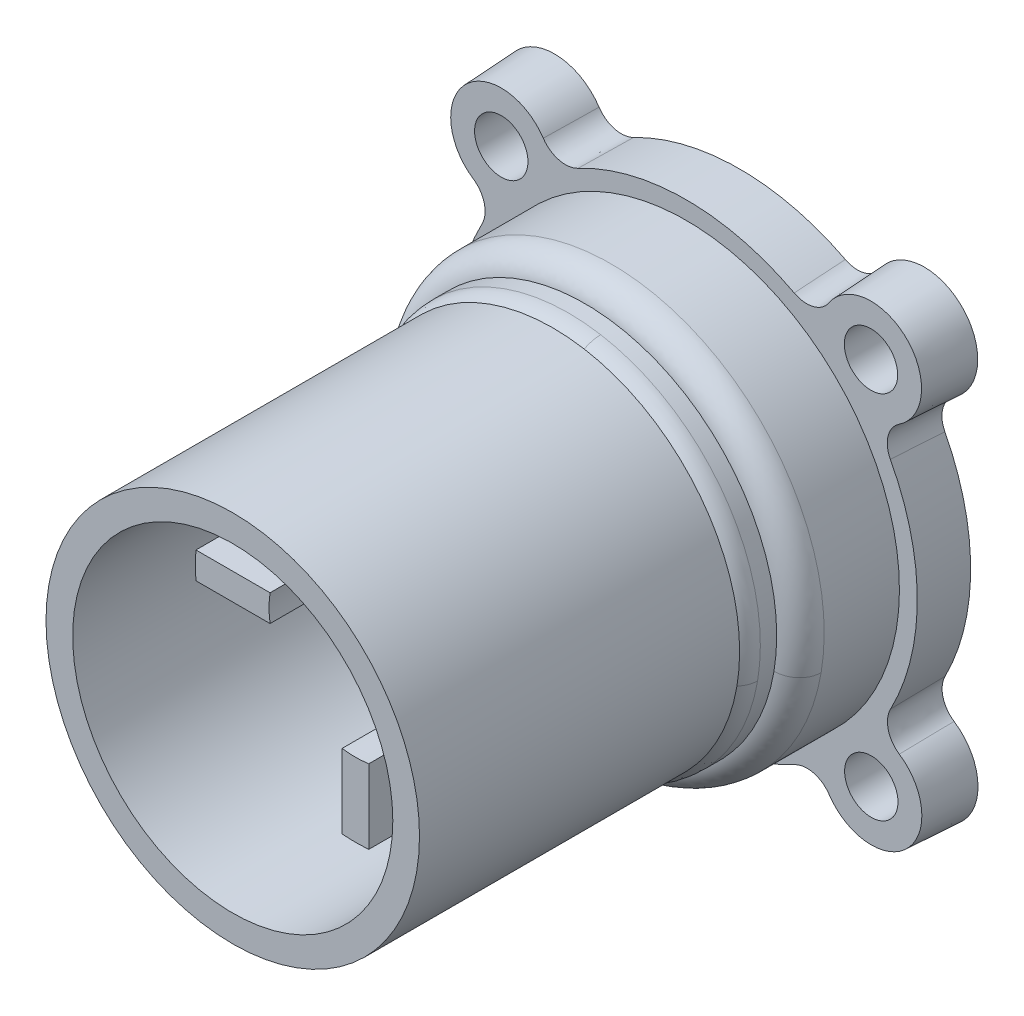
SolidWorks part; units mm, degrees
ref_plane "Plan de face" through (0, 0, 0) normal (0, 0, 1) x (1, 0, 0)
ref_plane "Plan de dessus" through (0, 0, 0) normal (0, 1, 0) x (1, 0, 0)
ref_plane "Plan de droite" through (0, 0, 0) normal (1, 0, 0) x (0, 0, -1)
imported_body "Importée3"
sketch "Esquisse1" plane through (0, 0, 7.5) normal (0, 0, 1) x (1, 0, 0)
  circle A0 centre (0, 0) radius 3.5
extrude "Boss.-Extru.1" add sketch "Esquisse1" along normal blind 6
sketch "Esquisse2" plane through (0, 0, 6.4101) normal (0, 0, -1) x (-1, 0, 0)
  circle A0 centre (0, 0) radius 3.995
extrude "Boss.-Extru.2" add sketch "Esquisse2" along normal blind 1.4101
ref_plane "Plan4" through (0, 0, 5) normal (0, 0, 1) x (1, 0, 0)
sketch "Esquisse3" plane through (0, 0, 5) normal (0, 0, 1) x (1, 0, 0)
  arc A0 (-2.4719, 3.5551) -> (-3.559, 2.4663) centre (-3.4676, 3.4621) ccw
  arc A1 (-3.559, 2.4663) -> (-2.4719, 3.5551) centre (0, 0) ccw
extrude "Boss.-Extru.3" add sketch "Esquisse3" against normal blind 1
hole_wizard "Diamètre du perçage Ø6.0 (6)1" positions "Esquisse5" profile "Esquisse4" hole size "Ø6.0" standard "Ansi Métrique"
sketch "Esquisse5" plane through (0, 0, 13.5) normal (0, 0, 1) x (1, 0, 0)
  point P0 (0, 0)
sketch "Esquisse4" plane through (0, 0, 13.5) normal (1, 0, 0) x (0, -1, 0)
  line L0 (0, 0) -> (0, 6)
  line L1 (0, 6) -> (3, 6)
  line L2 (3, 6) -> (3, 0)
  line L5 (3, 0) -> (0, 0)
  line L10 (0, 6) -> (-3, 6) construction
  line L11 (0, -6.35) -> (0, 107.95) construction
  dimension "Diamètre du perçage" = 6
  dimension "Profondeur du perçage" = 6
  dimension "Angle de pointe" = 180
sketch "Esquisse6" plane through (0, 0, 7.5) normal (0, 0, 1) x (1, 0, 0)
  line L0 (2.9896, -0.25) -> (0.25, -0.25)
  line L1 (0.25, -0.25) -> (0.25, -2.9896)
  arc A0 (0.25, -2.9896) -> (2.9896, -0.25) centre (0, 0) cw
extrude "Boss.-Extru.4" add sketch "Esquisse6" along normal blind 3.7
sketch "Esquisse7" plane through (0, 0, 11.2) normal (0, 0, 1) x (1, 0, 0)
  line L0 (-0.25, -0.25) -> (-2.9896, -0.25)
  line L1 (-0.25, -2.9896) -> (-0.25, -0.25)
  arc A0 (-2.9896, -0.25) -> (-0.25, -2.9896) centre (0, 0) ccw
extrude "Enlèv. mat.-Extru.1" cut sketch "Esquisse7" against normal blind 3.7
sketch "Esquisse8" plane through (0, 0, 11.2) normal (0, 0, 1) x (1, 0, 0)
  line L0 (0.25, 2.9896) -> (0.25, 0.25)
  line L1 (0.25, 0.25) -> (2.9896, 0.25)
  arc A0 (2.9896, 0.25) -> (0.25, 2.9896) centre (0, 0) ccw
extrude "Enlèv. mat.-Extru.2" cut sketch "Esquisse8" against normal blind 3.7
sketch "Esquisse9" plane through (0, 0, 11.2) normal (0, 0, 1) x (1, 0, 0)
  line L0 (-2.9896, 0.25) -> (-0.25, 0.25)
  line L1 (-0.25, 0.25) -> (-0.25, 2.9896)
  arc A0 (-0.25, 2.9896) -> (-2.9896, 0.25) centre (0, 0) ccw
extrude "Enlèv. mat.-Extru.3" cut sketch "Esquisse9" against normal blind 3.7
hole_wizard "Perçage1" positions "Esquisse11" profile "Esquisse10" legacy
sketch "Esquisse11" plane through (0, 0, 4) normal (0, 0, -1) x (-1, 0, 0)
  point P0 (0, 0)
sketch "Esquisse10" plane through (0, 0, 4) normal (1, 0, 0) x (0, 1, 0)
  line L0 (0, 0) -> (0, 3)
  line L1 (0, 3) -> (3.095, 3)
  line L2 (3.095, 3) -> (3.095, 2.4)
  line L3 (3.095, 2.4) -> (3.495, 2.4)
  line L4 (3.495, 2.4) -> (3.495, 0)
  line L5 (3.495, 0) -> (0, 0)
  line L6 (0, 110) -> (0, -10) construction
  dimension "Diamètre" = 6.19
  dimension "Profondeur" = 3
  dimension "Diamètre chambrage" = 6.99
  dimension "Profondeur chambrage" = 2.4
sketch "Esquisse12" plane through (0, 0, 6.4) normal (0, 0, -1) x (-1, 0, 0)
  arc A0 (-0.7265, 3.4187) -> (-0.2661, 3.4849) centre (0, 0) cw
  arc A1 (-0.3886, 3.1562) -> (-0.5163, 3.1378) centre (0, 0) ccw
  spline S0 degree 3 poles (-0.5163, 3.1378) (-0.5311, 3.1644) (-0.5471, 3.1904) (-0.564, 3.2158) (-0.5809, 3.2411) (-0.5987, 3.2659) (-0.6172, 3.2901) (-0.6514, 3.3348) (-0.688, 3.3776) (-0.7265, 3.4187) knots 0 0 0 0 0.000091 0.000091 0.000091 0.000183 0.000183 0.000183 0.000352 0.000352 0.000352 0.000352
  spline S1 degree 3 poles (-0.3886, 3.1562) (-0.3819, 3.1859) (-0.3739, 3.2153) (-0.3648, 3.2444) (-0.3557, 3.2735) (-0.3456, 3.3023) (-0.3347, 3.3307) (-0.3145, 3.3832) (-0.2914, 3.4346) (-0.2661, 3.4849) knots 0 0 0 0 0.000091 0.000091 0.000091 0.000183 0.000183 0.000183 0.000352 0.000352 0.000352 0.000352
extrude "Boss.-Extru.5" add sketch "Esquisse12" along normal blind 1.4
sketch "Esquisse13" plane through (0, 0, 6.4) normal (0, 0, -1) x (-1, 0, 0)
  arc A0 (-1.2056, 3.2805) -> (-0.7593, 3.4115) centre (0, 0) cw
  arc A1 (-0.8338, 3.0687) -> (-0.9576, 3.0324) centre (0, 0) ccw
  spline S0 degree 3 poles (-0.9576, 3.0324) (-0.9761, 3.0566) (-0.9956, 3.0801) (-1.0159, 3.1027) (-1.0363, 3.1254) (-1.0574, 3.1474) (-1.0791, 3.1687) (-1.1193, 3.2081) (-1.1617, 3.2453) (-1.2056, 3.2805) knots 0 0 0 0 0.000091 0.000091 0.000091 0.000183 0.000183 0.000183 0.000352 0.000352 0.000352 0.000352
  spline S1 degree 3 poles (-0.7593, 3.4115) (-0.7691, 3.3826) (-0.7781, 3.3535) (-0.7862, 3.3242) (-0.7944, 3.2949) (-0.8018, 3.2653) (-0.8083, 3.2356) (-0.8203, 3.1806) (-0.8294, 3.1248) (-0.8338, 3.0687) knots 0 0 0 0 0.000091 0.000091 0.000091 0.000183 0.000183 0.000183 0.000352 0.000352 0.000352 0.000352
extrude "Boss.-Extru.6" add sketch "Esquisse13" along normal blind 1.4
sketch "Esquisse14" plane through (0, 0, 6.4) normal (0, 0, -1) x (-1, 0, 0)
  arc A0 (-1.6602, 3.0755) -> (-1.2371, 3.2687) centre (0, 0) cw
  arc A1 (-1.2621, 2.9188) -> (-1.3794, 2.8652) centre (0, 0) ccw
  spline S0 degree 3 poles (-1.3794, 2.8652) (-1.4011, 2.8866) (-1.4238, 2.907) (-1.4472, 2.9266) (-1.4705, 2.9461) (-1.4946, 2.9649) (-1.5191, 2.9829) (-1.5645, 3.0162) (-1.6117, 3.047) (-1.6602, 3.0755) knots 0 0 0 0 0.000091 0.000091 0.000091 0.000183 0.000183 0.000183 0.000352 0.000352 0.000352 0.000352
  spline S1 degree 3 poles (-1.2371, 3.2687) (-1.2426, 3.2388) (-1.2474, 3.2087) (-1.2513, 3.1785) (-1.2553, 3.1483) (-1.2584, 3.118) (-1.2606, 3.0876) (-1.2646, 3.0315) (-1.2656, 2.975) (-1.2621, 2.9188) knots 0 0 0 0 0.000091 0.000091 0.000091 0.000183 0.000183 0.000183 0.000352 0.000352 0.000352 0.000352
extrude "Boss.-Extru.7" add sketch "Esquisse14" along normal blind 1.4
sketch "Esquisse15" plane through (0, 0, 6.4) normal (0, 0, -1) x (-1, 0, 0)
  arc A0 (-2.081, 2.8079) -> (-1.6897, 3.0594) centre (0, 0) cw
  arc A1 (-1.6646, 2.7095) -> (-1.7731, 2.6398) centre (0, 0) ccw
  spline S0 degree 3 poles (-1.7731, 2.6398) (-1.7977, 2.6578) (-1.823, 2.6748) (-1.8489, 2.6908) (-1.8748, 2.7069) (-1.9013, 2.722) (-1.9282, 2.7363) (-1.9778, 2.7628) (-2.0289, 2.7866) (-2.081, 2.8079) knots 0 0 0 0 0.000091 0.000091 0.000091 0.000183 0.000183 0.000183 0.000352 0.000352 0.000352 0.000352
  spline S1 degree 3 poles (-1.6897, 3.0594) (-1.6909, 3.029) (-1.6913, 2.9985) (-1.6909, 2.968) (-1.6905, 2.9376) (-1.6893, 2.9071) (-1.6872, 2.8768) (-1.6832, 2.8206) (-1.6761, 2.7646) (-1.6646, 2.7095) knots 0 0 0 0 0.000091 0.000091 0.000091 0.000183 0.000183 0.000183 0.000352 0.000352 0.000352 0.000352
extrude "Boss.-Extru.8" add sketch "Esquisse15" along normal blind 1.4
sketch "Esquisse16" plane through (0, 0, 6.4) normal (0, 0, -1) x (-1, 0, 0)
  arc A0 (-2.4594, 2.4832) -> (-2.1079, 2.7878) centre (0, 0) cw
  arc A1 (-2.0333, 2.445) -> (-2.1308, 2.3605) centre (0, 0) ccw
  spline S0 degree 3 poles (-2.1308, 2.3605) (-2.1576, 2.3749) (-2.1851, 2.3881) (-2.2131, 2.4003) (-2.241, 2.4125) (-2.2693, 2.4237) (-2.298, 2.4341) (-2.3509, 2.4532) (-2.4049, 2.4695) (-2.4594, 2.4832) knots 0 0 0 0 0.000091 0.000091 0.000091 0.000183 0.000183 0.000183 0.000352 0.000352 0.000352 0.000352
  spline S1 degree 3 poles (-2.1079, 2.7878) (-2.1048, 2.7575) (-2.1009, 2.7273) (-2.0961, 2.6972) (-2.0914, 2.6671) (-2.0858, 2.6371) (-2.0794, 2.6074) (-2.0675, 2.5524) (-2.0525, 2.4979) (-2.0333, 2.445) knots 0 0 0 0 0.000091 0.000091 0.000091 0.000183 0.000183 0.000183 0.000352 0.000352 0.000352 0.000352
extrude "Boss.-Extru.9" add sketch "Esquisse16" along normal blind 1.4
sketch "Esquisse17" plane through (0, 0, 6.4) normal (0, 0, -1) x (-1, 0, 0)
  arc A0 (-2.7878, 2.1079) -> (-2.4832, 2.4594) centre (0, 0) cw
  arc A1 (-2.3605, 2.1308) -> (-2.445, 2.0333) centre (0, 0) ccw
  spline S0 degree 3 poles (-2.445, 2.0333) (-2.4737, 2.0437) (-2.5028, 2.0528) (-2.5321, 2.0609) (-2.5615, 2.069) (-2.5912, 2.0761) (-2.621, 2.0823) (-2.6761, 2.0937) (-2.7318, 2.1021) (-2.7878, 2.1079) knots 0 0 0 0 0.000091 0.000091 0.000091 0.000183 0.000183 0.000183 0.000352 0.000352 0.000352 0.000352
  spline S1 degree 3 poles (-2.4832, 2.4594) (-2.4758, 2.4299) (-2.4676, 2.4005) (-2.4586, 2.3714) (-2.4497, 2.3423) (-2.4399, 2.3134) (-2.4293, 2.2849) (-2.4097, 2.2322) (-2.3871, 2.1804) (-2.3605, 2.1308) knots 0 0 0 0 0.000091 0.000091 0.000091 0.000183 0.000183 0.000183 0.000352 0.000352 0.000352 0.000352
extrude "Boss.-Extru.10" add sketch "Esquisse17" along normal blind 1.4
sketch "Esquisse18" plane through (0, 0, 6.4) normal (0, 0, -1) x (-1, 0, 0)
  arc A0 (-3.0594, 1.6897) -> (-2.8079, 2.081) centre (0, 0) cw
  arc A1 (-2.6398, 1.7731) -> (-2.7095, 1.6646) centre (0, 0) ccw
  spline S0 degree 3 poles (-2.7095, 1.6646) (-2.7393, 1.6709) (-2.7694, 1.6758) (-2.7997, 1.6796) (-2.8299, 1.6834) (-2.8602, 1.6862) (-2.8906, 1.6881) (-2.9468, 1.6915) (-3.0032, 1.6919) (-3.0594, 1.6897) knots 0 0 0 0 0.000091 0.000091 0.000091 0.000183 0.000183 0.000183 0.000352 0.000352 0.000352 0.000352
  spline S1 degree 3 poles (-2.8079, 2.081) (-2.7964, 2.0528) (-2.7841, 2.0249) (-2.7711, 1.9974) (-2.7581, 1.9698) (-2.7443, 1.9427) (-2.7297, 1.9159) (-2.7028, 1.8665) (-2.6731, 1.8185) (-2.6398, 1.7731) knots 0 0 0 0 0.000091 0.000091 0.000091 0.000183 0.000183 0.000183 0.000352 0.000352 0.000352 0.000352
extrude "Boss.-Extru.11" add sketch "Esquisse18" along normal blind 1.4
sketch "Esquisse19" plane through (0, 0, 6.4) normal (0, 0, -1) x (-1, 0, 0)
  arc A0 (-3.2687, 1.2371) -> (-3.0755, 1.6602) centre (0, 0) cw
  arc A1 (-2.8652, 1.3794) -> (-2.9188, 1.2621) centre (0, 0) ccw
  spline S0 degree 3 poles (-2.9188, 1.2621) (-2.9492, 1.264) (-2.9797, 1.2646) (-3.0102, 1.2641) (-3.0407, 1.2636) (-3.0711, 1.262) (-3.1015, 1.2595) (-3.1575, 1.2549) (-3.2134, 1.2473) (-3.2687, 1.2371) knots 0 0 0 0 0.000091 0.000091 0.000091 0.000183 0.000183 0.000183 0.000352 0.000352 0.000352 0.000352
  spline S1 degree 3 poles (-3.0755, 1.6602) (-3.0601, 1.6339) (-3.044, 1.6081) (-3.0272, 1.5827) (-3.0104, 1.5573) (-2.9929, 1.5323) (-2.9746, 1.5079) (-2.9409, 1.4629) (-2.9047, 1.4195) (-2.8652, 1.3794) knots 0 0 0 0 0.000091 0.000091 0.000091 0.000183 0.000183 0.000183 0.000352 0.000352 0.000352 0.000352
extrude "Boss.-Extru.12" add sketch "Esquisse19" along normal blind 1.4
sketch "Esquisse20" plane through (0, 0, 6.4) normal (0, 0, -1) x (-1, 0, 0)
  arc A0 (-3.4115, 0.7593) -> (-3.2805, 1.2056) centre (0, 0) cw
  arc A1 (-3.0324, 0.9576) -> (-3.0687, 0.8338) centre (0, 0) ccw
  spline S0 degree 3 poles (-3.0687, 0.8338) (-3.0991, 0.8314) (-3.1294, 0.8276) (-3.1595, 0.8228) (-3.1895, 0.818) (-3.2194, 0.8121) (-3.2491, 0.8053) (-3.304, 0.7928) (-3.3582, 0.7773) (-3.4115, 0.7593) knots 0 0 0 0 0.000091 0.000091 0.000091 0.000183 0.000183 0.000183 0.000352 0.000352 0.000352 0.000352
  spline S1 degree 3 poles (-3.2805, 1.2056) (-3.2614, 1.1818) (-3.2418, 1.1585) (-3.2216, 1.1358) (-3.2013, 1.113) (-3.1805, 1.0908) (-3.1589, 1.0693) (-3.1192, 1.0295) (-3.0771, 0.9917) (-3.0324, 0.9576) knots 0 0 0 0 0.000091 0.000091 0.000091 0.000183 0.000183 0.000183 0.000352 0.000352 0.000352 0.000352
extrude "Boss.-Extru.13" add sketch "Esquisse20" along normal blind 1.4
sketch "Esquisse21" plane through (0, 0, 6.4) normal (0, 0, -1) x (-1, 0, 0)
  arc A0 (-3.4849, 0.2661) -> (-3.4187, 0.7265) centre (0, 0) cw
  arc A1 (-3.1378, 0.5163) -> (-3.1562, 0.3886) centre (0, 0) ccw
  spline S0 degree 3 poles (-3.1562, 0.3886) (-3.1859, 0.3819) (-3.2153, 0.3739) (-3.2444, 0.3648) (-3.2735, 0.3557) (-3.3022, 0.3456) (-3.3307, 0.3347) (-3.3832, 0.3145) (-3.4346, 0.2914) (-3.4849, 0.2661) knots 0 0 0 0 0.000091 0.000091 0.000091 0.000183 0.000183 0.000183 0.000352 0.000352 0.000352 0.000352
  spline S1 degree 3 poles (-3.4187, 0.7265) (-3.3964, 0.7056) (-3.3737, 0.6854) (-3.3504, 0.6657) (-3.3271, 0.6461) (-3.3033, 0.6271) (-3.279, 0.6088) (-3.2339, 0.5751) (-3.187, 0.5437) (-3.1378, 0.5163) knots 0 0 0 0 0.000091 0.000091 0.000091 0.000183 0.000183 0.000183 0.000352 0.000352 0.000352 0.000352
extrude "Boss.-Extru.14" add sketch "Esquisse21" along normal blind 1.4
sketch "Esquisse22" plane through (0, 0, 6.4) normal (0, 0, -1) x (-1, 0, 0)
  arc A0 (-3.4873, -0.2325) -> (-3.4873, 0.2325) centre (0, 0) cw
  arc A1 (-3.1793, 0.0645) -> (-3.1793, -0.0645) centre (0, 0) ccw
  spline S0 degree 3 poles (-3.1793, -0.0645) (-3.2078, -0.0754) (-3.2358, -0.0875) (-3.2633, -0.1007) (-3.2908, -0.1138) (-3.3178, -0.1278) (-3.3444, -0.1427) (-3.3935, -0.1701) (-3.4412, -0.2003) (-3.4873, -0.2325) knots 0 0 0 0 0.000091 0.000091 0.000091 0.000183 0.000183 0.000183 0.000352 0.000352 0.000352 0.000352
  spline S1 degree 3 poles (-3.4873, 0.2325) (-3.4623, 0.2151) (-3.4369, 0.1983) (-3.4111, 0.1821) (-3.3852, 0.166) (-3.3589, 0.1506) (-3.3322, 0.136) (-3.2829, 0.109) (-3.2319, 0.0846) (-3.1793, 0.0645) knots 0 0 0 0 0.000091 0.000091 0.000091 0.000183 0.000183 0.000183 0.000352 0.000352 0.000352 0.000352
extrude "Boss.-Extru.15" add sketch "Esquisse22" along normal blind 1.4
sketch "Esquisse23" plane through (0, 0, 6.4) normal (0, 0, -1) x (-1, 0, 0)
  arc A0 (-3.4187, -0.7265) -> (-3.4849, -0.2661) centre (0, 0) cw
  arc A1 (-3.1562, -0.3886) -> (-3.1378, -0.5163) centre (0, 0) ccw
  spline S0 degree 3 poles (-3.1378, -0.5163) (-3.1644, -0.5311) (-3.1904, -0.5471) (-3.2158, -0.564) (-3.2411, -0.5809) (-3.2659, -0.5987) (-3.2901, -0.6172) (-3.3348, -0.6514) (-3.3776, -0.688) (-3.4187, -0.7265) knots 0 0 0 0 0.000091 0.000091 0.000091 0.000183 0.000183 0.000183 0.000352 0.000352 0.000352 0.000352
  spline S1 degree 3 poles (-3.4849, -0.2661) (-3.4577, -0.2798) (-3.4301, -0.2929) (-3.4023, -0.3052) (-3.3744, -0.3174) (-3.3462, -0.329) (-3.3177, -0.3396) (-3.265, -0.3593) (-3.211, -0.3762) (-3.1562, -0.3886) knots 0 0 0 0 0.000091 0.000091 0.000091 0.000183 0.000183 0.000183 0.000352 0.000352 0.000352 0.000352
extrude "Boss.-Extru.16" add sketch "Esquisse23" along normal blind 1.4
sketch "Esquisse24" plane through (0, 0, 6.4) normal (0, 0, -1) x (-1, 0, 0)
  arc A0 (-3.2805, -1.2056) -> (-3.4115, -0.7593) centre (0, 0) cw
  arc A1 (-3.0687, -0.8338) -> (-3.0324, -0.9576) centre (0, 0) ccw
  spline S0 degree 3 poles (-3.0324, -0.9576) (-3.0566, -0.9761) (-3.0801, -0.9956) (-3.1027, -1.0159) (-3.1254, -1.0363) (-3.1474, -1.0574) (-3.1687, -1.0791) (-3.2081, -1.1193) (-3.2453, -1.1617) (-3.2805, -1.2056) knots 0 0 0 0 0.000091 0.000091 0.000091 0.000183 0.000183 0.000183 0.000352 0.000352 0.000352 0.000352
  spline S1 degree 3 poles (-3.4115, -0.7593) (-3.3826, -0.7691) (-3.3535, -0.7781) (-3.3242, -0.7862) (-3.2949, -0.7944) (-3.2653, -0.8018) (-3.2356, -0.8083) (-3.1806, -0.8203) (-3.1248, -0.8294) (-3.0687, -0.8338) knots 0 0 0 0 0.000091 0.000091 0.000091 0.000183 0.000183 0.000183 0.000352 0.000352 0.000352 0.000352
extrude "Boss.-Extru.17" add sketch "Esquisse24" along normal blind 1.4
sketch "Esquisse25" plane through (0, 0, 6.4) normal (0, 0, -1) x (-1, 0, 0)
  arc A0 (-3.0755, -1.6602) -> (-3.2687, -1.2371) centre (0, 0) cw
  arc A1 (-2.9188, -1.2621) -> (-2.8652, -1.3794) centre (0, 0) ccw
  spline S0 degree 3 poles (-2.8652, -1.3794) (-2.8866, -1.4011) (-2.907, -1.4238) (-2.9266, -1.4472) (-2.9461, -1.4705) (-2.9649, -1.4946) (-2.9829, -1.5191) (-3.0162, -1.5645) (-3.047, -1.6117) (-3.0755, -1.6602) knots 0 0 0 0 0.000091 0.000091 0.000091 0.000183 0.000183 0.000183 0.000352 0.000352 0.000352 0.000352
  spline S1 degree 3 poles (-3.2687, -1.2371) (-3.2388, -1.2426) (-3.2087, -1.2474) (-3.1785, -1.2513) (-3.1483, -1.2553) (-3.118, -1.2584) (-3.0876, -1.2606) (-3.0315, -1.2646) (-2.975, -1.2656) (-2.9188, -1.2621) knots 0 0 0 0 0.000091 0.000091 0.000091 0.000183 0.000183 0.000183 0.000352 0.000352 0.000352 0.000352
extrude "Boss.-Extru.18" add sketch "Esquisse25" along normal blind 1.4
sketch "Esquisse26" plane through (0, 0, 6.4) normal (0, 0, -1) x (-1, 0, 0)
  arc A0 (-2.8079, -2.081) -> (-3.0594, -1.6897) centre (0, 0) cw
  arc A1 (-2.7095, -1.6646) -> (-2.6398, -1.7731) centre (0, 0) ccw
  spline S0 degree 3 poles (-2.6398, -1.7731) (-2.6578, -1.7977) (-2.6748, -1.823) (-2.6908, -1.8489) (-2.7069, -1.8748) (-2.722, -1.9013) (-2.7363, -1.9282) (-2.7628, -1.9778) (-2.7866, -2.0289) (-2.8079, -2.081) knots 0 0 0 0 0.000091 0.000091 0.000091 0.000183 0.000183 0.000183 0.000352 0.000352 0.000352 0.000352
  spline S1 degree 3 poles (-3.0594, -1.6897) (-3.029, -1.6909) (-2.9985, -1.6913) (-2.968, -1.6909) (-2.9376, -1.6905) (-2.9071, -1.6893) (-2.8768, -1.6872) (-2.8206, -1.6832) (-2.7646, -1.6761) (-2.7095, -1.6646) knots 0 0 0 0 0.000091 0.000091 0.000091 0.000183 0.000183 0.000183 0.000352 0.000352 0.000352 0.000352
extrude "Boss.-Extru.19" add sketch "Esquisse26" along normal blind 1.4
sketch "Esquisse27" plane through (0, 0, 6.4) normal (0, 0, -1) x (-1, 0, 0)
  arc A0 (-2.4832, -2.4594) -> (-2.7878, -2.1079) centre (0, 0) cw
  arc A1 (-2.445, -2.0333) -> (-2.3605, -2.1308) centre (0, 0) ccw
  spline S0 degree 3 poles (-2.3605, -2.1308) (-2.3749, -2.1576) (-2.3881, -2.1851) (-2.4003, -2.2131) (-2.4125, -2.241) (-2.4237, -2.2693) (-2.4341, -2.298) (-2.4532, -2.3509) (-2.4695, -2.4049) (-2.4832, -2.4594) knots 0 0 0 0 0.000091 0.000091 0.000091 0.000183 0.000183 0.000183 0.000352 0.000352 0.000352 0.000352
  spline S1 degree 3 poles (-2.7878, -2.1079) (-2.7575, -2.1048) (-2.7273, -2.1009) (-2.6972, -2.0961) (-2.6671, -2.0914) (-2.6371, -2.0858) (-2.6074, -2.0794) (-2.5524, -2.0675) (-2.4979, -2.0525) (-2.445, -2.0333) knots 0 0 0 0 0.000091 0.000091 0.000091 0.000183 0.000183 0.000183 0.000352 0.000352 0.000352 0.000352
extrude "Boss.-Extru.20" add sketch "Esquisse27" along normal blind 1.4
sketch "Esquisse28" plane through (0, 0, 6.4) normal (0, 0, -1) x (-1, 0, 0)
  arc A0 (-2.1079, -2.7878) -> (-2.4594, -2.4832) centre (0, 0) cw
  arc A1 (-2.1308, -2.3605) -> (-2.0333, -2.445) centre (0, 0) ccw
  spline S0 degree 3 poles (-2.0333, -2.445) (-2.0437, -2.4737) (-2.0528, -2.5028) (-2.0609, -2.5321) (-2.069, -2.5615) (-2.0761, -2.5912) (-2.0823, -2.621) (-2.0937, -2.6761) (-2.1021, -2.7318) (-2.1079, -2.7878) knots 0 0 0 0 0.000091 0.000091 0.000091 0.000183 0.000183 0.000183 0.000352 0.000352 0.000352 0.000352
  spline S1 degree 3 poles (-2.4594, -2.4832) (-2.4299, -2.4758) (-2.4005, -2.4676) (-2.3714, -2.4586) (-2.3423, -2.4497) (-2.3134, -2.4399) (-2.2849, -2.4293) (-2.2322, -2.4097) (-2.1804, -2.3871) (-2.1308, -2.3605) knots 0 0 0 0 0.000091 0.000091 0.000091 0.000183 0.000183 0.000183 0.000352 0.000352 0.000352 0.000352
extrude "Boss.-Extru.21" add sketch "Esquisse28" along normal blind 1.4
sketch "Esquisse29" plane through (0, 0, 6.4) normal (0, 0, -1) x (-1, 0, 0)
  arc A0 (-1.6897, -3.0594) -> (-2.081, -2.8079) centre (0, 0) cw
  arc A1 (-1.7731, -2.6398) -> (-1.6646, -2.7095) centre (0, 0) ccw
  spline S0 degree 3 poles (-1.6646, -2.7095) (-1.6709, -2.7393) (-1.6758, -2.7694) (-1.6796, -2.7997) (-1.6834, -2.8299) (-1.6862, -2.8602) (-1.6881, -2.8906) (-1.6915, -2.9468) (-1.6919, -3.0032) (-1.6897, -3.0594) knots 0 0 0 0 0.000091 0.000091 0.000091 0.000183 0.000183 0.000183 0.000352 0.000352 0.000352 0.000352
  spline S1 degree 3 poles (-2.081, -2.8079) (-2.0528, -2.7964) (-2.0249, -2.7841) (-1.9974, -2.7711) (-1.9698, -2.7581) (-1.9427, -2.7443) (-1.9159, -2.7297) (-1.8665, -2.7028) (-1.8185, -2.6731) (-1.7731, -2.6398) knots 0 0 0 0 0.000091 0.000091 0.000091 0.000183 0.000183 0.000183 0.000352 0.000352 0.000352 0.000352
extrude "Boss.-Extru.22" add sketch "Esquisse29" along normal blind 1.4
sketch "Esquisse30" plane through (0, 0, 6.4) normal (0, 0, -1) x (-1, 0, 0)
  arc A0 (-1.2371, -3.2687) -> (-1.6602, -3.0755) centre (0, 0) cw
  arc A1 (-1.3794, -2.8652) -> (-1.2621, -2.9188) centre (0, 0) ccw
  spline S0 degree 3 poles (-1.2621, -2.9188) (-1.264, -2.9492) (-1.2646, -2.9797) (-1.2641, -3.0102) (-1.2636, -3.0407) (-1.262, -3.0711) (-1.2595, -3.1015) (-1.2549, -3.1575) (-1.2473, -3.2134) (-1.2371, -3.2687) knots 0 0 0 0 0.000091 0.000091 0.000091 0.000183 0.000183 0.000183 0.000352 0.000352 0.000352 0.000352
  spline S1 degree 3 poles (-1.6602, -3.0755) (-1.6339, -3.0601) (-1.6081, -3.044) (-1.5827, -3.0272) (-1.5573, -3.0104) (-1.5323, -2.9929) (-1.5079, -2.9746) (-1.4629, -2.9409) (-1.4195, -2.9047) (-1.3794, -2.8652) knots 0 0 0 0 0.000091 0.000091 0.000091 0.000183 0.000183 0.000183 0.000352 0.000352 0.000352 0.000352
extrude "Boss.-Extru.23" add sketch "Esquisse30" along normal blind 1.4
sketch "Esquisse31" plane through (0, 0, 6.4) normal (0, 0, -1) x (-1, 0, 0)
  arc A0 (-0.7593, -3.4115) -> (-1.2056, -3.2805) centre (0, 0) cw
  arc A1 (-0.9576, -3.0324) -> (-0.8338, -3.0687) centre (0, 0) ccw
  spline S0 degree 3 poles (-0.8338, -3.0687) (-0.8314, -3.0991) (-0.8276, -3.1294) (-0.8228, -3.1595) (-0.818, -3.1895) (-0.8121, -3.2194) (-0.8053, -3.2491) (-0.7928, -3.304) (-0.7773, -3.3582) (-0.7593, -3.4115) knots 0 0 0 0 0.000091 0.000091 0.000091 0.000183 0.000183 0.000183 0.000352 0.000352 0.000352 0.000352
  spline S1 degree 3 poles (-1.2056, -3.2805) (-1.1818, -3.2614) (-1.1585, -3.2418) (-1.1358, -3.2216) (-1.113, -3.2013) (-1.0908, -3.1805) (-1.0693, -3.1589) (-1.0295, -3.1192) (-0.9917, -3.0771) (-0.9576, -3.0324) knots 0 0 0 0 0.000091 0.000091 0.000091 0.000183 0.000183 0.000183 0.000352 0.000352 0.000352 0.000352
extrude "Boss.-Extru.24" add sketch "Esquisse31" along normal blind 1.4
sketch "Esquisse32" plane through (0, 0, 6.4) normal (0, 0, -1) x (-1, 0, 0)
  arc A0 (-0.2661, -3.4849) -> (-0.7265, -3.4187) centre (0, 0) cw
  arc A1 (-0.5163, -3.1378) -> (-0.3886, -3.1562) centre (0, 0) ccw
  spline S0 degree 3 poles (-0.3886, -3.1562) (-0.3819, -3.1859) (-0.3739, -3.2153) (-0.3648, -3.2444) (-0.3557, -3.2735) (-0.3456, -3.3022) (-0.3347, -3.3307) (-0.3145, -3.3832) (-0.2914, -3.4346) (-0.2661, -3.4849) knots 0 0 0 0 0.000091 0.000091 0.000091 0.000183 0.000183 0.000183 0.000352 0.000352 0.000352 0.000352
  spline S1 degree 3 poles (-0.7265, -3.4187) (-0.7056, -3.3964) (-0.6854, -3.3737) (-0.6657, -3.3504) (-0.6461, -3.3271) (-0.6271, -3.3033) (-0.6088, -3.279) (-0.5751, -3.2339) (-0.5437, -3.187) (-0.5163, -3.1378) knots 0 0 0 0 0.000091 0.000091 0.000091 0.000183 0.000183 0.000183 0.000352 0.000352 0.000352 0.000352
extrude "Boss.-Extru.25" add sketch "Esquisse32" along normal blind 1.4
sketch "Esquisse33" plane through (0, 0, 6.4) normal (0, 0, -1) x (-1, 0, 0)
  arc A0 (0.2325, -3.4873) -> (-0.2325, -3.4873) centre (0, 0) cw
  arc A1 (-0.0645, -3.1793) -> (0.0645, -3.1793) centre (0, 0) ccw
  spline S0 degree 3 poles (0.0645, -3.1793) (0.0754, -3.2078) (0.0875, -3.2358) (0.1007, -3.2633) (0.1138, -3.2908) (0.1278, -3.3178) (0.1427, -3.3444) (0.1701, -3.3935) (0.2003, -3.4412) (0.2325, -3.4873) knots 0 0 0 0 0.000091 0.000091 0.000091 0.000183 0.000183 0.000183 0.000352 0.000352 0.000352 0.000352
  spline S1 degree 3 poles (-0.2325, -3.4873) (-0.2151, -3.4623) (-0.1983, -3.4369) (-0.1821, -3.4111) (-0.166, -3.3852) (-0.1506, -3.3589) (-0.136, -3.3322) (-0.109, -3.2829) (-0.0846, -3.2319) (-0.0645, -3.1793) knots 0 0 0 0 0.000091 0.000091 0.000091 0.000183 0.000183 0.000183 0.000352 0.000352 0.000352 0.000352
extrude "Boss.-Extru.26" add sketch "Esquisse33" along normal blind 1.4
sketch "Esquisse34" plane through (0, 0, 6.4) normal (0, 0, -1) x (-1, 0, 0)
  arc A0 (0.7265, -3.4187) -> (0.2661, -3.4849) centre (0, 0) cw
  arc A1 (0.3886, -3.1562) -> (0.5163, -3.1378) centre (0, 0) ccw
  spline S0 degree 3 poles (0.7265, -3.4187) (0.7056, -3.3964) (0.6854, -3.3737) (0.6657, -3.3504) (0.6461, -3.3272) (0.6271, -3.3033) (0.6088, -3.279) (0.5751, -3.234) (0.5437, -3.187) (0.5163, -3.1378) knots 0 0 0 0 0.000091 0.000091 0.000091 0.000183 0.000183 0.000183 0.000352 0.000352 0.000352 0.000352
  spline S1 degree 3 poles (0.2661, -3.4849) (0.2798, -3.4577) (0.2929, -3.4301) (0.3052, -3.4023) (0.3174, -3.3744) (0.329, -3.3462) (0.3396, -3.3177) (0.3593, -3.265) (0.3762, -3.211) (0.3886, -3.1562) knots 0 0 0 0 0.000091 0.000091 0.000091 0.000183 0.000183 0.000183 0.000352 0.000352 0.000352 0.000352
extrude "Boss.-Extru.27" add sketch "Esquisse34" along normal blind 1.4
sketch "Esquisse35" plane through (0, 0, 6.4) normal (0, 0, -1) x (-1, 0, 0)
  arc A0 (1.2056, -3.2805) -> (0.7593, -3.4115) centre (0, 0) cw
  arc A1 (0.8338, -3.0687) -> (0.9576, -3.0324) centre (0, 0) ccw
  spline S0 degree 3 poles (1.2056, -3.2805) (1.1818, -3.2615) (1.1585, -3.2418) (1.1358, -3.2216) (1.113, -3.2013) (1.0908, -3.1805) (1.0693, -3.159) (1.0295, -3.1192) (0.9917, -3.0771) (0.9576, -3.0324) knots 0 0 0 0 0.000091 0.000091 0.000091 0.000183 0.000183 0.000183 0.000352 0.000352 0.000352 0.000352
  spline S1 degree 3 poles (0.8338, -3.0687) (0.8314, -3.0991) (0.8276, -3.1294) (0.8228, -3.1595) (0.818, -3.1895) (0.8121, -3.2195) (0.8053, -3.2492) (0.7928, -3.304) (0.7773, -3.3582) (0.7593, -3.4115) knots 0 0 0 0 0.000091 0.000091 0.000091 0.000183 0.000183 0.000183 0.000352 0.000352 0.000352 0.000352
extrude "Boss.-Extru.28" add sketch "Esquisse35" along normal blind 1.4
sketch "Esquisse36" plane through (0, 0, 6.4) normal (0, 0, -1) x (-1, 0, 0)
  arc A0 (1.6602, -3.0755) -> (1.2371, -3.2687) centre (0, 0) cw
  arc A1 (1.2621, -2.9188) -> (1.3794, -2.8652) centre (0, 0) ccw
  spline S0 degree 3 poles (1.6602, -3.0755) (1.634, -3.0601) (1.6081, -3.044) (1.5827, -3.0272) (1.5573, -3.0104) (1.5323, -2.9929) (1.508, -2.9746) (1.4629, -2.9409) (1.4195, -2.9047) (1.3794, -2.8652) knots 0 0 0 0 0.000091 0.000091 0.000091 0.000183 0.000183 0.000183 0.000352 0.000352 0.000352 0.000352
  spline S1 degree 3 poles (1.2621, -2.9188) (1.264, -2.9492) (1.2646, -2.9797) (1.2641, -3.0102) (1.2636, -3.0407) (1.262, -3.0711) (1.2595, -3.1015) (1.2549, -3.1575) (1.2473, -3.2134) (1.2371, -3.2687) knots 0 0 0 0 0.000091 0.000091 0.000091 0.000183 0.000183 0.000183 0.000352 0.000352 0.000352 0.000352
extrude "Boss.-Extru.29" add sketch "Esquisse36" along normal blind 1.4
sketch "Esquisse37" plane through (0, 0, 6.4) normal (0, 0, -1) x (-1, 0, 0)
  arc A0 (2.081, -2.8079) -> (1.6897, -3.0594) centre (0, 0) cw
  arc A1 (1.6646, -2.7095) -> (1.7731, -2.6398) centre (0, 0) ccw
  spline S0 degree 3 poles (2.081, -2.8079) (2.0528, -2.7964) (2.0249, -2.7841) (1.9974, -2.7711) (1.9699, -2.7581) (1.9427, -2.7443) (1.9159, -2.7297) (1.8665, -2.7028) (1.8185, -2.6731) (1.7731, -2.6398) knots 0 0 0 0 0.000091 0.000091 0.000091 0.000183 0.000183 0.000183 0.000352 0.000352 0.000352 0.000352
  spline S1 degree 3 poles (1.6646, -2.7095) (1.6709, -2.7393) (1.6758, -2.7695) (1.6796, -2.7997) (1.6834, -2.8299) (1.6862, -2.8603) (1.6881, -2.8907) (1.6915, -2.9468) (1.6919, -3.0032) (1.6897, -3.0594) knots 0 0 0 0 0.000091 0.000091 0.000091 0.000183 0.000183 0.000183 0.000352 0.000352 0.000352 0.000352
extrude "Boss.-Extru.30" add sketch "Esquisse37" along normal blind 1.4
sketch "Esquisse38" plane through (0, 0, 6.4) normal (0, 0, -1) x (-1, 0, 0)
  arc A0 (2.4594, -2.4832) -> (2.1079, -2.7878) centre (0, 0) cw
  arc A1 (2.0333, -2.445) -> (2.1308, -2.3605) centre (0, 0) ccw
  spline S0 degree 3 poles (2.4594, -2.4832) (2.4299, -2.4758) (2.4005, -2.4676) (2.3714, -2.4586) (2.3423, -2.4497) (2.3135, -2.4399) (2.2849, -2.4293) (2.2322, -2.4097) (2.1804, -2.3871) (2.1308, -2.3605) knots 0 0 0 0 0.000091 0.000091 0.000091 0.000183 0.000183 0.000183 0.000352 0.000352 0.000352 0.000352
  spline S1 degree 3 poles (2.0333, -2.445) (2.0437, -2.4737) (2.0528, -2.5028) (2.0609, -2.5321) (2.069, -2.5615) (2.0761, -2.5912) (2.0823, -2.621) (2.0937, -2.6761) (2.1021, -2.7318) (2.1079, -2.7878) knots 0 0 0 0 0.000091 0.000091 0.000091 0.000183 0.000183 0.000183 0.000352 0.000352 0.000352 0.000352
extrude "Boss.-Extru.31" add sketch "Esquisse38" along normal blind 1.4
sketch "Esquisse39" plane through (0, 0, 6.4) normal (0, 0, -1) x (-1, 0, 0)
  arc A0 (2.7878, -2.1079) -> (2.4832, -2.4594) centre (0, 0) cw
  arc A1 (2.3605, -2.1308) -> (2.445, -2.0333) centre (0, 0) ccw
  spline S0 degree 3 poles (2.7878, -2.1079) (2.7575, -2.1048) (2.7273, -2.1009) (2.6972, -2.0961) (2.6671, -2.0914) (2.6371, -2.0858) (2.6074, -2.0794) (2.5524, -2.0675) (2.4979, -2.0525) (2.445, -2.0333) knots 0 0 0 0 0.000091 0.000091 0.000091 0.000183 0.000183 0.000183 0.000352 0.000352 0.000352 0.000352
  spline S1 degree 3 poles (2.3605, -2.1308) (2.3749, -2.1576) (2.3881, -2.1851) (2.4003, -2.2131) (2.4125, -2.241) (2.4237, -2.2693) (2.4341, -2.298) (2.4532, -2.3509) (2.4695, -2.4049) (2.4832, -2.4594) knots 0 0 0 0 0.000091 0.000091 0.000091 0.000183 0.000183 0.000183 0.000352 0.000352 0.000352 0.000352
extrude "Boss.-Extru.32" add sketch "Esquisse39" along normal blind 1.4
sketch "Esquisse40" plane through (0, 0, 6.4) normal (0, 0, -1) x (-1, 0, 0)
  arc A0 (3.0594, -1.6897) -> (2.8079, -2.081) centre (0, 0) cw
  arc A1 (2.6398, -1.7731) -> (2.7095, -1.6646) centre (0, 0) ccw
  spline S0 degree 3 poles (3.0594, -1.6897) (3.029, -1.6909) (2.9985, -1.6913) (2.968, -1.6909) (2.9376, -1.6905) (2.9071, -1.6893) (2.8768, -1.6872) (2.8207, -1.6832) (2.7646, -1.6761) (2.7095, -1.6646) knots 0 0 0 0 0.000091 0.000091 0.000091 0.000183 0.000183 0.000183 0.000352 0.000352 0.000352 0.000352
  spline S1 degree 3 poles (2.6398, -1.7731) (2.6578, -1.7977) (2.6748, -1.823) (2.6908, -1.8489) (2.7069, -1.8748) (2.722, -1.9013) (2.7364, -1.9282) (2.7628, -1.9778) (2.7866, -2.0289) (2.8079, -2.081) knots 0 0 0 0 0.000091 0.000091 0.000091 0.000183 0.000183 0.000183 0.000352 0.000352 0.000352 0.000352
extrude "Boss.-Extru.33" add sketch "Esquisse40" along normal blind 1.4
sketch "Esquisse41" plane through (0, 0, 6.4) normal (0, 0, -1) x (-1, 0, 0)
  arc A0 (3.2687, -1.2371) -> (3.0755, -1.6602) centre (0, 0) cw
  arc A1 (2.8652, -1.3794) -> (2.9188, -1.2621) centre (0, 0) ccw
  spline S0 degree 3 poles (3.2687, -1.2371) (3.2388, -1.2426) (3.2087, -1.2474) (3.1785, -1.2513) (3.1483, -1.2553) (3.118, -1.2584) (3.0876, -1.2606) (3.0315, -1.2646) (2.975, -1.2656) (2.9188, -1.2621) knots 0 0 0 0 0.000091 0.000091 0.000091 0.000183 0.000183 0.000183 0.000352 0.000352 0.000352 0.000352
  spline S1 degree 3 poles (2.8652, -1.3794) (2.8866, -1.4011) (2.907, -1.4238) (2.9266, -1.4472) (2.9461, -1.4705) (2.9649, -1.4946) (2.9829, -1.5191) (3.0162, -1.5645) (3.047, -1.6117) (3.0755, -1.6602) knots 0 0 0 0 0.000091 0.000091 0.000091 0.000183 0.000183 0.000183 0.000352 0.000352 0.000352 0.000352
extrude "Boss.-Extru.34" add sketch "Esquisse41" along normal blind 1.4
sketch "Esquisse42" plane through (0, 0, 6.4) normal (0, 0, -1) x (-1, 0, 0)
  arc A0 (3.4115, -0.7593) -> (3.2805, -1.2056) centre (0, 0) cw
  arc A1 (3.0324, -0.9576) -> (3.0687, -0.8338) centre (0, 0) ccw
  spline S0 degree 3 poles (3.4115, -0.7593) (3.3827, -0.7691) (3.3535, -0.7781) (3.3242, -0.7862) (3.2949, -0.7944) (3.2653, -0.8018) (3.2356, -0.8083) (3.1806, -0.8203) (3.1248, -0.8294) (3.0687, -0.8338) knots 0 0 0 0 0.000091 0.000091 0.000091 0.000183 0.000183 0.000183 0.000352 0.000352 0.000352 0.000352
  spline S1 degree 3 poles (3.0324, -0.9576) (3.0566, -0.9761) (3.0801, -0.9956) (3.1028, -1.016) (3.1254, -1.0363) (3.1474, -1.0574) (3.1687, -1.0792) (3.2081, -1.1193) (3.2453, -1.1617) (3.2805, -1.2056) knots 0 0 0 0 0.000091 0.000091 0.000091 0.000183 0.000183 0.000183 0.000352 0.000352 0.000352 0.000352
extrude "Boss.-Extru.35" add sketch "Esquisse42" along normal blind 1.4
sketch "Esquisse43" plane through (0, 0, 6.4) normal (0, 0, -1) x (-1, 0, 0)
  arc A0 (3.4849, -0.2661) -> (3.4187, -0.7265) centre (0, 0) cw
  arc A1 (3.1378, -0.5163) -> (3.1562, -0.3886) centre (0, 0) ccw
  spline S0 degree 3 poles (3.4849, -0.2661) (3.4577, -0.2798) (3.4301, -0.2929) (3.4023, -0.3052) (3.3744, -0.3174) (3.3462, -0.329) (3.3177, -0.3396) (3.265, -0.3593) (3.211, -0.3762) (3.1562, -0.3886) knots 0 0 0 0 0.000091 0.000091 0.000091 0.000183 0.000183 0.000183 0.000352 0.000352 0.000352 0.000352
  spline S1 degree 3 poles (3.1378, -0.5163) (3.1644, -0.5311) (3.1904, -0.5471) (3.2158, -0.564) (3.2411, -0.5809) (3.2659, -0.5987) (3.2901, -0.6172) (3.3348, -0.6514) (3.3776, -0.688) (3.4187, -0.7265) knots 0 0 0 0 0.000091 0.000091 0.000091 0.000183 0.000183 0.000183 0.000352 0.000352 0.000352 0.000352
extrude "Boss.-Extru.36" add sketch "Esquisse43" along normal blind 1.4
sketch "Esquisse44" plane through (0, 0, 6.4) normal (0, 0, -1) x (-1, 0, 0)
  arc A0 (3.4873, 0.2325) -> (3.4873, -0.2325) centre (0, 0) cw
  arc A1 (3.1793, -0.0645) -> (3.1793, 0.0645) centre (0, 0) ccw
  spline S0 degree 3 poles (3.4873, 0.2325) (3.4623, 0.2151) (3.4369, 0.1983) (3.4111, 0.1821) (3.3852, 0.166) (3.359, 0.1506) (3.3322, 0.136) (3.2829, 0.109) (3.2319, 0.0846) (3.1793, 0.0645) knots 0 0 0 0 0.000091 0.000091 0.000091 0.000183 0.000183 0.000183 0.000352 0.000352 0.000352 0.000352
  spline S1 degree 3 poles (3.1793, -0.0645) (3.2078, -0.0754) (3.2358, -0.0875) (3.2633, -0.1007) (3.2908, -0.1138) (3.3178, -0.1279) (3.3444, -0.1427) (3.3935, -0.1701) (3.4412, -0.2003) (3.4873, -0.2325) knots 0 0 0 0 0.000091 0.000091 0.000091 0.000183 0.000183 0.000183 0.000352 0.000352 0.000352 0.000352
extrude "Boss.-Extru.37" add sketch "Esquisse44" along normal blind 1.4
sketch "Esquisse45" plane through (0, 0, 6.4) normal (0, 0, -1) x (-1, 0, 0)
  arc A0 (3.4187, 0.7265) -> (3.4849, 0.2661) centre (0, 0) cw
  arc A1 (3.1562, 0.3886) -> (3.1378, 0.5163) centre (0, 0) ccw
  spline S0 degree 3 poles (3.4187, 0.7265) (3.3964, 0.7056) (3.3737, 0.6854) (3.3504, 0.6657) (3.3272, 0.6461) (3.3033, 0.6271) (3.279, 0.6088) (3.234, 0.5751) (3.187, 0.5437) (3.1378, 0.5163) knots 0 0 0 0 0.000091 0.000091 0.000091 0.000183 0.000183 0.000183 0.000352 0.000352 0.000352 0.000352
  spline S1 degree 3 poles (3.1562, 0.3886) (3.1859, 0.3819) (3.2153, 0.3739) (3.2444, 0.3648) (3.2735, 0.3557) (3.3023, 0.3456) (3.3307, 0.3347) (3.3832, 0.3145) (3.4346, 0.2914) (3.4849, 0.2661) knots 0 0 0 0 0.000091 0.000091 0.000091 0.000183 0.000183 0.000183 0.000352 0.000352 0.000352 0.000352
extrude "Boss.-Extru.38" add sketch "Esquisse45" along normal blind 1.4
sketch "Esquisse46" plane through (0, 0, 6.4) normal (0, 0, -1) x (-1, 0, 0)
  arc A0 (3.2805, 1.2056) -> (3.4115, 0.7593) centre (0, 0) cw
  arc A1 (3.0687, 0.8338) -> (3.0324, 0.9576) centre (0, 0) ccw
  spline S0 degree 3 poles (3.2805, 1.2056) (3.2615, 1.1818) (3.2418, 1.1585) (3.2216, 1.1358) (3.2013, 1.113) (3.1805, 1.0908) (3.159, 1.0693) (3.1192, 1.0295) (3.0771, 0.9917) (3.0324, 0.9576) knots 0 0 0 0 0.000091 0.000091 0.000091 0.000183 0.000183 0.000183 0.000352 0.000352 0.000352 0.000352
  spline S1 degree 3 poles (3.0687, 0.8338) (3.0991, 0.8314) (3.1294, 0.8276) (3.1595, 0.8228) (3.1895, 0.818) (3.2195, 0.8121) (3.2492, 0.8053) (3.304, 0.7928) (3.3582, 0.7773) (3.4115, 0.7593) knots 0 0 0 0 0.000091 0.000091 0.000091 0.000183 0.000183 0.000183 0.000352 0.000352 0.000352 0.000352
extrude "Boss.-Extru.39" add sketch "Esquisse46" along normal blind 1.4
sketch "Esquisse47" plane through (0, 0, 6.4) normal (0, 0, -1) x (-1, 0, 0)
  arc A0 (3.0755, 1.6602) -> (3.2687, 1.2371) centre (0, 0) cw
  arc A1 (2.9188, 1.2621) -> (2.8652, 1.3794) centre (0, 0) ccw
  spline S0 degree 3 poles (3.0755, 1.6602) (3.0601, 1.634) (3.044, 1.6081) (3.0272, 1.5827) (3.0104, 1.5573) (2.9929, 1.5323) (2.9746, 1.508) (2.9409, 1.4629) (2.9047, 1.4195) (2.8652, 1.3794) knots 0 0 0 0 0.000091 0.000091 0.000091 0.000183 0.000183 0.000183 0.000352 0.000352 0.000352 0.000352
  spline S1 degree 3 poles (2.9188, 1.2621) (2.9492, 1.264) (2.9797, 1.2646) (3.0102, 1.2641) (3.0407, 1.2636) (3.0711, 1.262) (3.1015, 1.2595) (3.1575, 1.2549) (3.2134, 1.2473) (3.2687, 1.2371) knots 0 0 0 0 0.000091 0.000091 0.000091 0.000183 0.000183 0.000183 0.000352 0.000352 0.000352 0.000352
extrude "Boss.-Extru.40" add sketch "Esquisse47" along normal blind 1.4
sketch "Esquisse48" plane through (0, 0, 6.4) normal (0, 0, -1) x (-1, 0, 0)
  arc A0 (2.8079, 2.081) -> (3.0594, 1.6897) centre (0, 0) cw
  arc A1 (2.7095, 1.6646) -> (2.6398, 1.7731) centre (0, 0) ccw
  spline S0 degree 3 poles (2.8079, 2.081) (2.7964, 2.0528) (2.7841, 2.0249) (2.7711, 1.9974) (2.7581, 1.9699) (2.7443, 1.9427) (2.7297, 1.9159) (2.7028, 1.8665) (2.6731, 1.8185) (2.6398, 1.7731) knots 0 0 0 0 0.000091 0.000091 0.000091 0.000183 0.000183 0.000183 0.000352 0.000352 0.000352 0.000352
  spline S1 degree 3 poles (2.7095, 1.6646) (2.7393, 1.6709) (2.7695, 1.6758) (2.7997, 1.6796) (2.8299, 1.6834) (2.8603, 1.6862) (2.8907, 1.6881) (2.9468, 1.6915) (3.0032, 1.6919) (3.0594, 1.6897) knots 0 0 0 0 0.000091 0.000091 0.000091 0.000183 0.000183 0.000183 0.000352 0.000352 0.000352 0.000352
extrude "Boss.-Extru.41" add sketch "Esquisse48" along normal blind 1.4
sketch "Esquisse49" plane through (0, 0, 6.4) normal (0, 0, -1) x (-1, 0, 0)
  arc A0 (2.4832, 2.4594) -> (2.7878, 2.1079) centre (0, 0) cw
  arc A1 (2.445, 2.0333) -> (2.3605, 2.1308) centre (0, 0) ccw
  spline S0 degree 3 poles (2.4832, 2.4594) (2.4758, 2.4299) (2.4676, 2.4005) (2.4586, 2.3714) (2.4497, 2.3423) (2.4399, 2.3135) (2.4293, 2.2849) (2.4097, 2.2322) (2.3871, 2.1804) (2.3605, 2.1308) knots 0 0 0 0 0.000091 0.000091 0.000091 0.000183 0.000183 0.000183 0.000352 0.000352 0.000352 0.000352
  spline S1 degree 3 poles (2.445, 2.0333) (2.4737, 2.0437) (2.5028, 2.0528) (2.5321, 2.0609) (2.5615, 2.069) (2.5912, 2.0761) (2.621, 2.0823) (2.6761, 2.0937) (2.7318, 2.1021) (2.7878, 2.1079) knots 0 0 0 0 0.000091 0.000091 0.000091 0.000183 0.000183 0.000183 0.000352 0.000352 0.000352 0.000352
extrude "Boss.-Extru.42" add sketch "Esquisse49" along normal blind 1.4
sketch "Esquisse50" plane through (0, 0, 6.4) normal (0, 0, -1) x (-1, 0, 0)
  arc A0 (2.1079, 2.7878) -> (2.4594, 2.4832) centre (0, 0) cw
  arc A1 (2.1308, 2.3605) -> (2.0333, 2.445) centre (0, 0) ccw
  spline S0 degree 3 poles (2.1079, 2.7878) (2.1048, 2.7575) (2.1009, 2.7273) (2.0961, 2.6972) (2.0914, 2.6671) (2.0858, 2.6371) (2.0794, 2.6074) (2.0675, 2.5524) (2.0525, 2.4979) (2.0333, 2.445) knots 0 0 0 0 0.000091 0.000091 0.000091 0.000183 0.000183 0.000183 0.000352 0.000352 0.000352 0.000352
  spline S1 degree 3 poles (2.1308, 2.3605) (2.1576, 2.3749) (2.1851, 2.3881) (2.2131, 2.4003) (2.241, 2.4125) (2.2693, 2.4237) (2.298, 2.4341) (2.3509, 2.4532) (2.4049, 2.4695) (2.4594, 2.4832) knots 0 0 0 0 0.000091 0.000091 0.000091 0.000183 0.000183 0.000183 0.000352 0.000352 0.000352 0.000352
extrude "Boss.-Extru.43" add sketch "Esquisse50" along normal blind 1.4
sketch "Esquisse51" plane through (0, 0, 6.4) normal (0, 0, -1) x (-1, 0, 0)
  arc A0 (1.6897, 3.0594) -> (2.081, 2.8079) centre (0, 0) cw
  arc A1 (1.7731, 2.6398) -> (1.6646, 2.7095) centre (0, 0) ccw
  spline S0 degree 3 poles (1.6897, 3.0594) (1.6909, 3.029) (1.6913, 2.9985) (1.6909, 2.968) (1.6905, 2.9376) (1.6893, 2.9071) (1.6872, 2.8768) (1.6832, 2.8207) (1.6761, 2.7646) (1.6646, 2.7095) knots 0 0 0 0 0.000091 0.000091 0.000091 0.000183 0.000183 0.000183 0.000352 0.000352 0.000352 0.000352
  spline S1 degree 3 poles (1.7731, 2.6398) (1.7977, 2.6578) (1.823, 2.6748) (1.8489, 2.6908) (1.8748, 2.7069) (1.9013, 2.722) (1.9282, 2.7364) (1.9778, 2.7628) (2.0289, 2.7866) (2.081, 2.8079) knots 0 0 0 0 0.000091 0.000091 0.000091 0.000183 0.000183 0.000183 0.000352 0.000352 0.000352 0.000352
extrude "Boss.-Extru.44" add sketch "Esquisse51" along normal blind 1.4
sketch "Esquisse52" plane through (0, 0, 6.4) normal (0, 0, -1) x (-1, 0, 0)
  arc A0 (1.2371, 3.2687) -> (1.6602, 3.0755) centre (0, 0) cw
  arc A1 (1.3794, 2.8652) -> (1.2621, 2.9188) centre (0, 0) ccw
  spline S0 degree 3 poles (1.2371, 3.2687) (1.2426, 3.2388) (1.2474, 3.2087) (1.2513, 3.1785) (1.2553, 3.1483) (1.2584, 3.118) (1.2606, 3.0876) (1.2646, 3.0315) (1.2656, 2.975) (1.2621, 2.9188) knots 0 0 0 0 0.000091 0.000091 0.000091 0.000183 0.000183 0.000183 0.000352 0.000352 0.000352 0.000352
  spline S1 degree 3 poles (1.3794, 2.8652) (1.4011, 2.8866) (1.4238, 2.907) (1.4472, 2.9266) (1.4705, 2.9461) (1.4946, 2.9649) (1.5191, 2.9829) (1.5645, 3.0162) (1.6117, 3.047) (1.6602, 3.0755) knots 0 0 0 0 0.000091 0.000091 0.000091 0.000183 0.000183 0.000183 0.000352 0.000352 0.000352 0.000352
extrude "Boss.-Extru.45" add sketch "Esquisse52" along normal blind 1.4
sketch "Esquisse53" plane through (0, 0, 6.4) normal (0, 0, -1) x (-1, 0, 0)
  arc A0 (0.7593, 3.4115) -> (1.2056, 3.2805) centre (0, 0) cw
  arc A1 (0.9576, 3.0324) -> (0.8338, 3.0687) centre (0, 0) ccw
  spline S0 degree 3 poles (0.7593, 3.4115) (0.7691, 3.3827) (0.7781, 3.3535) (0.7862, 3.3242) (0.7944, 3.2949) (0.8018, 3.2653) (0.8083, 3.2356) (0.8203, 3.1806) (0.8294, 3.1248) (0.8338, 3.0687) knots 0 0 0 0 0.000091 0.000091 0.000091 0.000183 0.000183 0.000183 0.000352 0.000352 0.000352 0.000352
  spline S1 degree 3 poles (0.9576, 3.0324) (0.9761, 3.0566) (0.9956, 3.0801) (1.016, 3.1028) (1.0363, 3.1254) (1.0574, 3.1474) (1.0792, 3.1687) (1.1193, 3.2081) (1.1617, 3.2453) (1.2056, 3.2805) knots 0 0 0 0 0.000091 0.000091 0.000091 0.000183 0.000183 0.000183 0.000352 0.000352 0.000352 0.000352
extrude "Boss.-Extru.46" add sketch "Esquisse53" along normal blind 1.4
sketch "Esquisse54" plane through (0, 0, 6.4) normal (0, 0, -1) x (-1, 0, 0)
  arc A0 (0.2661, 3.4849) -> (0.7265, 3.4187) centre (0, 0) cw
  arc A1 (0.5163, 3.1378) -> (0.3886, 3.1562) centre (0, 0) ccw
  spline S0 degree 3 poles (0.2661, 3.4849) (0.2798, 3.4577) (0.2929, 3.4301) (0.3052, 3.4023) (0.3174, 3.3744) (0.329, 3.3462) (0.3396, 3.3177) (0.3593, 3.265) (0.3762, 3.211) (0.3886, 3.1562) knots 0 0 0 0 0.000091 0.000091 0.000091 0.000183 0.000183 0.000183 0.000352 0.000352 0.000352 0.000352
  spline S1 degree 3 poles (0.5163, 3.1378) (0.5311, 3.1644) (0.5471, 3.1904) (0.564, 3.2158) (0.5809, 3.2411) (0.5987, 3.2659) (0.6172, 3.2901) (0.6514, 3.3348) (0.688, 3.3776) (0.7265, 3.4187) knots 0 0 0 0 0.000091 0.000091 0.000091 0.000183 0.000183 0.000183 0.000352 0.000352 0.000352 0.000352
extrude "Boss.-Extru.47" add sketch "Esquisse54" along normal blind 1.4
sketch "Esquisse55" plane through (0, 0, 6.4) normal (0, 0, -1) x (-1, 0, 0)
  arc A0 (-0.2325, 3.4873) -> (0.2325, 3.4873) centre (0, 0) cw
  arc A1 (0.0645, 3.1793) -> (-0.0645, 3.1793) centre (0, 0) ccw
  spline S0 degree 3 poles (-0.0645, 3.1793) (-0.0754, 3.2078) (-0.0875, 3.2358) (-0.1007, 3.2633) (-0.1138, 3.2908) (-0.1278, 3.3178) (-0.1427, 3.3444) (-0.1701, 3.3935) (-0.2003, 3.4412) (-0.2325, 3.4873) knots 0 0 0 0 0.000091 0.000091 0.000091 0.000183 0.000183 0.000183 0.000352 0.000352 0.000352 0.000352
  spline S1 degree 3 poles (0.2325, 3.4873) (0.2151, 3.4623) (0.1983, 3.4369) (0.1821, 3.4111) (0.166, 3.3852) (0.1506, 3.3589) (0.136, 3.3322) (0.109, 3.2829) (0.0846, 3.2319) (0.0645, 3.1793) knots 0 0 0 0 0.000091 0.000091 0.000091 0.000183 0.000183 0.000183 0.000352 0.000352 0.000352 0.000352
extrude "Boss.-Extru.48" add sketch "Esquisse55" along normal blind 1.4
ref_plane "Plan5" through (0, 0, 4) normal (0, 0, -1) x (-1, 0, 0)
sketch "Esquisse56" plane through (0, 0, 4) normal (0, 0, -1) x (-1, 0, 0)
  arc A0 (-3.5551, 2.4719) -> (-2.4663, 3.559) centre (0, 0) cw
  arc A1 (-2.4663, 3.559) -> (-3.5551, 2.4719) centre (-3.4621, 3.4676) ccw
extrude "Boss.-Extru.49" add sketch "Esquisse56" against normal blind 1
sketch "Esquisse57" plane through (0, 0, 4) normal (0, 0, -1) x (-1, 0, 0)
  arc A0 (-2.4719, -3.5551) -> (-3.559, -2.4663) centre (0, 0) cw
  arc A1 (-3.559, -2.4663) -> (-2.4719, -3.5551) centre (-3.4676, -3.4621) ccw
extrude "Boss.-Extru.50" add sketch "Esquisse57" against normal blind 1
sketch "Esquisse58" plane through (0, 0, 4) normal (0, 0, -1) x (-1, 0, 0)
  arc A0 (3.5551, -2.4719) -> (2.4663, -3.559) centre (0, 0) cw
  arc A1 (2.4663, -3.559) -> (3.5551, -2.4719) centre (3.4621, -3.4676) ccw
extrude "Boss.-Extru.51" add sketch "Esquisse58" against normal blind 1
draft "Dépouille1" type of draft neutral plane draft angle 3 faces to draft 4 parameters "D1"=3
sketch "Esquisse59" plane through (0, 0, 0) normal (0, 1, 0) x (1, 0, 0)
  line L0 (3.495, -4) -> (3.495, -4.5)
  line L1 (3.495, -4.5) -> (3.83, -4.5)
  line L2 (3.83, -4.5) -> (3.83, -4)
  line L3 (3.83, -4) -> (3.495, -4)
  line L4 (0, -4) -> (0, -4.5) construction
revolve "Enlèvement de matière-Révolution1" cut sketch "Esquisse59" angle 360 about L4
ref_plane "Plan6" through (0, 0, 0) normal (0, -1, 0) x (1, 0, 0)
sketch "Esquisse60" plane through (0, 0, 0) normal (0, -1, 0) x (1, 0, 0)
  line L0 (2, 7) -> (0, 7)
  line L1 (0, 7) -> (0, 6.9)
  line L2 (0, 6.9) -> (2, 6.9)
  line L3 (2, 6.9) -> (2, 7)
  line L4 (0, 7) -> (0, 6.9) construction
revolve "Révolution1" add sketch "Esquisse60" angle 360 about L4
hole_wizard "Diamètre du perçage Ø1.0 (1)1" positions "Esquisse62" profile "Esquisse61" hole size "Ø1.0" standard "Ansi Métrique"
sketch "Esquisse62" plane through (0, 0, 4) normal (0, 0, -1) x (-1, 0, 0)
  point P0 (-3.4621, 3.4676)
  point P1 (-3.4676, -3.4621)
  point P2 (3.4621, -3.4676)
  point P3 (3.4676, 3.4621)
sketch "Esquisse61" plane through (3.4621, 3.4676, 4) normal (1, 0, 0) x (0, 1, 0)
  line L0 (0, 0) -> (0, 9.5)
  line L1 (0, 9.5) -> (0.5, 9.5)
  line L2 (0.5, 9.5) -> (0.5, 0)
  line L5 (0.5, 0) -> (0, 0)
  line L11 (0, -6.35) -> (0, 107.95) construction
  dimension "Diamètre du perçage jusqu'au prochain" = 1
  dimension "Profondeur du perçage jusqu'au prochain" = 9.5
hole_wizard "Dégagement M31" positions "Esquisse64" profile "Esquisse63" hole size "M3" standard "Ansi Métrique"
sketch "Esquisse64" plane through (0, 0, 6.9) normal (0, 0, -1) x (-1, 0, 0)
  point P0 (0, 0)
sketch "Esquisse63" plane through (0, 0, 6.9) normal (1, 0, 0) x (0, 1, 0)
  line L0 (0, 0) -> (0, 6.6)
  line L1 (0, 6.6) -> (1.62, 6.6)
  line L2 (1.62, 6.6) -> (1.62, 0)
  line L5 (1.62, 0) -> (0, 0)
  line L11 (0, -6.35) -> (0, 107.95) construction
  dimension "Diamètre du perçage jusqu'au prochain" = 3.24
  dimension "Profondeur du perçage jusqu'au prochain" = 6.6
fillet "Congé1" radius 0.5 8 edges
